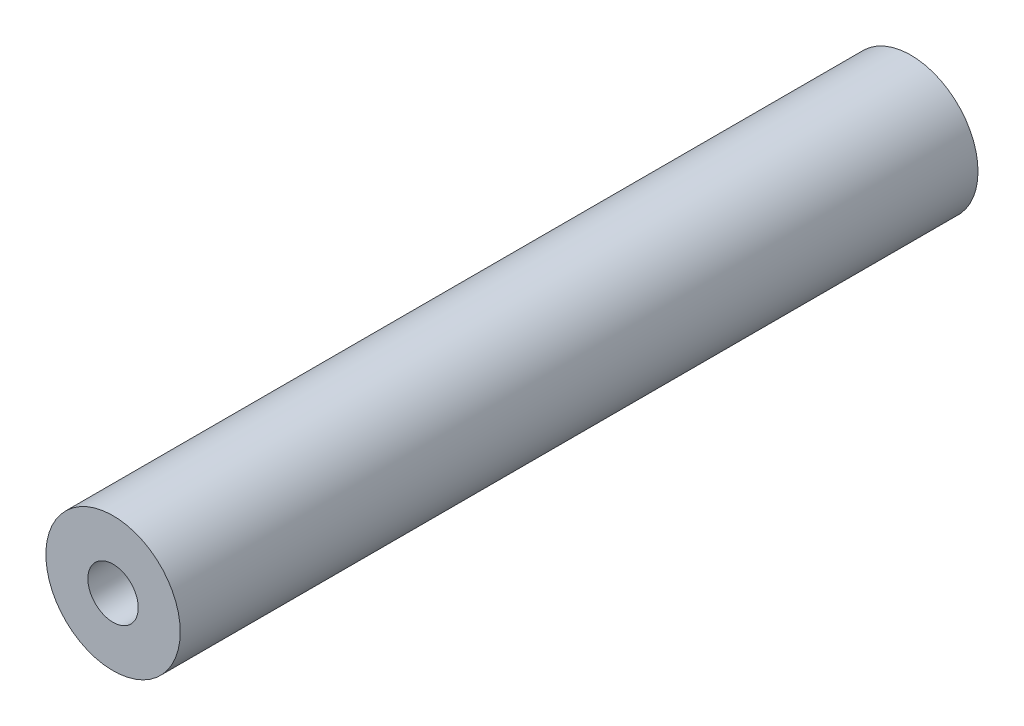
SolidWorks part; units mm, degrees
ref_plane "前视基准面" through (0, 0, 0) normal (0, 0, 1) x (1, 0, 0)
ref_plane "上视基准面" through (0, 0, 0) normal (0, 1, 0) x (1, 0, 0)
ref_plane "右视基准面" through (0, 0, 0) normal (1, 0, 0) x (0, 0, -1)
sketch "草图1" plane through (0, 0, 0) normal (0, 0, 1) x (1, 0, 0)
  circle A0 centre (0, 0) radius 3
  circle A1 centre (0, 0) radius 8
  dimension "D1" = 6
  dimension "D2" = 16
extrude "凸台-拉伸1" add sketch "草图1" along normal mid plane 95
